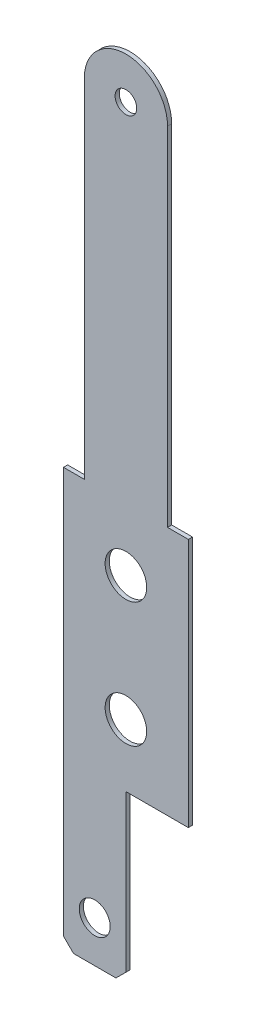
SolidWorks part; units mm, degrees
ref_plane "Front Plane" through (0, 0, 0) normal (0, 0, 1) x (1, 0, 0)
ref_plane "Top Plane" through (0, 0, 0) normal (0, 1, 0) x (1, 0, 0)
ref_plane "Right Plane" through (0, 0, 0) normal (1, 0, 0) x (0, 0, -1)
sketch "Sketch1" plane through (0, 0, 0) normal (0, 0, 1) x (1, 0, 0)
  line L0 (0, 0) -> (0, 75.2348) construction
  line L2 (-4.7625, 52.451) -> (-4.7625, 0)
  line L3 (-4.7625, 0) -> (4.7625, 0)
  line L4 (4.7625, 52.451) -> (4.7625, 0)
  arc A0 (4.7625, 52.451) -> (-4.7625, 52.451) centre (0, 59.1937) ccw
  dimension "D3" = 16.51
  dimension "D1" = 9.525
  dimension "D2" = 52.451
extrude "Boss-Extrude1" add sketch "Sketch1" along normal blind 0.3175
sketch "Sketch2" plane through (0, 0, 0.3175) normal (0, 0, 1) x (1, 0, 0)
  circle A0 centre (0, 59.1937) radius 1.5875
  dimension "D1" = 3.175
extrude "Cut-Extrude1" cut sketch "Sketch2" against normal through all
sketch "Sketch3" plane through (0, 0, 0.3175) normal (0, 0, 1) x (1, 0, 0)
  line L0 (0, 0) -> (0, 20.3348) construction
  line L1 (-4.7625, 0) -> (4.7625, 0) construction
  circle A0 centre (0, 4.7625) radius 1.5875
  circle A1 centre (0, 14.2875) radius 1.5875
  dimension "D1" = 3.175
  dimension "D2" = 9.525
  dimension "D3" = 4.7625
extrude "Cut-Extrude2" cut sketch "Sketch3" against normal through all
sketch "Sketch4" plane through (0, 0, 0.3175) normal (0, 0, 1) x (1, 0, 0)
  line L0 (0, 0) -> (0, 53.8003) construction
  line L1 (-4.7625, 0) -> (4.7625, 0) construction
  circle A0 centre (0, 45.5676) radius 0.8255
  dimension "D1" = 1.651
  dimension "D2" = 45.5676
extrude "Cut-Extrude3" cut sketch "Sketch4" against normal through all
sketch "Sketch5" plane through (0, 0, 0.3175) normal (0, 0, 1) x (1, 0, 0)
  line L0 (-2.3813, -12.7) -> (-2.3813, -3.2529) construction
  line L1 (-4.7625, 0) -> (0, 0)
  line L2 (-4.7625, 0) -> (-4.7625, -12.7)
  line L3 (-4.7625, -12.7) -> (0, -12.7)
  line L4 (0, 0) -> (0, -12.7)
  circle A0 centre (-2.3813, -9.525) radius 1.1811
  dimension "D3" = 2.3622
  dimension "D4" = 3.175
  dimension "D1" = 4.7625
  dimension "D2" = 12.7
extrude "Boss-Extrude2" add sketch "Sketch5" against normal through all
chamfer "Chamfer1" distance 0.762 angle 45 2 edges at (-4.7625, -12.7, 0.1588) (0, -12.7, 0.1588)
sketch "Sketch6" plane through (0, 0, 0.3175) normal (0, 0, 1) x (1, 0, 0)
  line L0 (-4.7625, 19.05) -> (-3.175, 19.05)
  line L1 (-4.7625, 52.451) -> (-4.7625, -11.938) construction
  line L2 (-3.175, 19.05) -> (-3.175, 45.5676)
  line L3 (0, 1.9067) -> (0, 10.8289) construction
  line L4 (4.7625, 19.05) -> (3.175, 19.05)
  line L5 (3.175, 19.05) -> (3.175, 45.5676)
  line L6 (0, 0) -> (4.7625, 0) construction
  arc A0 (-3.175, 45.5676) -> (3.175, 45.5676) centre (0, 45.5676) cw
  circle A1 centre (0, 45.5676) radius 0.8255 construction
  dimension "D1" = 19.05
  dimension "D2" = 6.35
extrude "Cut-Extrude4" cut sketch "Sketch6" along normal through all and the other way through all flip side to cut
